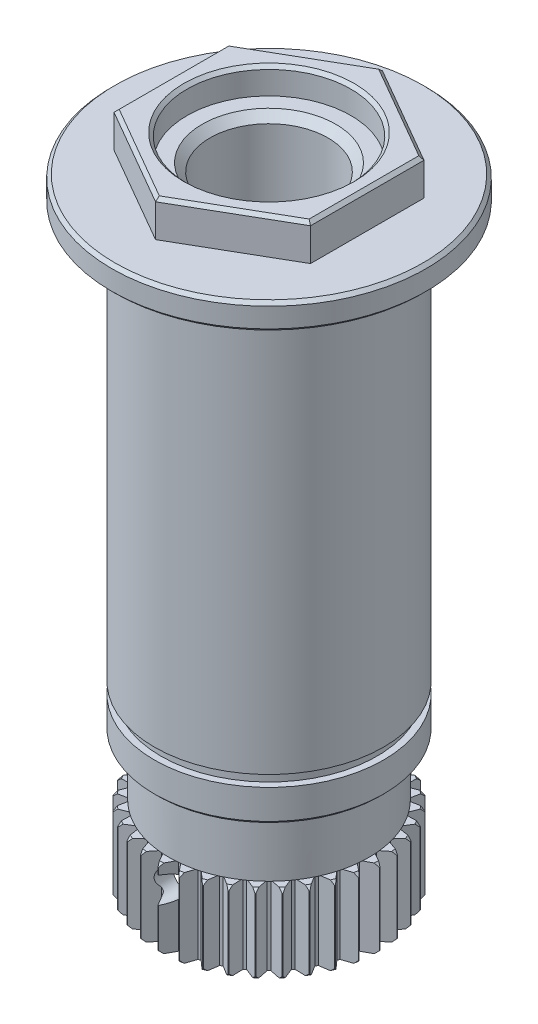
SolidWorks part; units mm, degrees
ref_plane "Plan de face" through (0, 0, 0) normal (0, 0, 1) x (1, 0, 0)
ref_plane "Plan de dessus" through (0, 0, 0) normal (0, 1, 0) x (1, 0, 0)
ref_plane "Plan de droite" through (0, 0, 0) normal (1, 0, 0) x (0, 0, -1)
sketch "Esquisse1" plane through (0, 0, 0) normal (0, 0, 1) x (1, 0, 0)
  line L0 (0, 102.8382) -> (0, -101.254) construction
  line L1 (-12.5, 9.5) -> (-12.5, 5.5)
  line L2 (-12.5, 5.5) -> (-9, 5.5)
  line L3 (-9, 5.5) -> (-9, -6.5)
  line L4 (-12.5, 9.5) -> (-15, 9.5)
  line L5 (-15, 9.5) -> (-15, 4)
  line L6 (-15, 4) -> (-24, 4)
  line L7 (-24, 4) -> (-24, 0)
  line L8 (-24, 0) -> (-17.5, 0)
  line L9 (-17.5, 0) -> (-17.5, -63)
  line L10 (-9, -6.5) -> (-8.1, -6.5)
  line L11 (-8.1, -6.5) -> (-8.1, -60)
  line L20 (-8.1, -60) -> (-9, -60)
  line L21 (-9, -60) -> (-9, -74.7)
  line L23 (-12.85, -74.7) -> (-9, -74.7)
  line L24 (-12.85, -74.7) -> (-12.85, -90.7)
  line L25 (-17.5, -63) -> (-16.5, -63)
  line L26 (-16.5, -63) -> (-16.5, -64.7)
  line L27 (-16.5, -64.7) -> (-17.5, -64.7)
  line L28 (-17.5, -64.7) -> (-17.5, -69.7)
  line L29 (-17.5, -69.7) -> (-15.25, -69.7)
  line L30 (-15.25, -69.7) -> (-15.25, -78.7)
  line L31 (-15.25, -78.7) -> (-16.9, -78.7)
  line L33 (-16.9, -90.7) -> (-12.85, -90.7)
  line L38 (-16.9, -78.7) -> (-16.9, -90.7)
  dimension "D1" = 9
  dimension "D2" = 12.5
  dimension "D3" = 15
  dimension "D4" = 4
  dimension "D5" = 5.5
  dimension "D6" = 24
  dimension "D7" = 17.5
  dimension "D8" = 12
  dimension "D9" = 8.1
  dimension "D10" = 64.7
  dimension "D11" = 16.9
  dimension "D12" = 4
  dimension "D13" = 30.7
  dimension "D19" = 9
  dimension "D20" = 16
  dimension "D22" = 12.85
  dimension "D24" = 100.2
  dimension "D26" = 1.7
  dimension "D27" = 16.5
  dimension "D28" = 17.5
  dimension "D30" = 15.25
  dimension "D31" = 9
  dimension "D33" = 12
revolve "Révolution1" add sketch "Esquisse1" angle 360 about L0
sketch "Esquisse7" plane through (0, 9.5, 0) normal (0, 1, 0) x (-1, 0, 0)
  line L0 (28.486, 0) -> (-27.1796, 0) construction
  line L1 (0, 0) -> (0, -29.2118) construction
  line L2 (0, 0) -> (0, 28.7037) construction
  line L3 (15, -8.6603) -> (15, 8.6603)
  line L4 (-15, -8.6603) -> (-15, 8.6603)
  line L5 (15, 8.6603) -> (0, 17.3205)
  line L6 (0, 17.3205) -> (-15, 8.6603)
  line L7 (15, -8.6603) -> (0, -17.3205)
  line L8 (0, -17.3205) -> (-15, -8.6603)
  circle A1 centre (0, 0) radius 12.5 construction
  circle A2 centre (0, 0) radius 12.5
  dimension "D1" = 30
  dimension "D2" = 30
  dimension "D3" = 30
  dimension "D4" = 120
extrude "Extrusion2" add sketch "Esquisse7" against normal up to surface (5.5 mm away)
sketch "Esquisse10" plane through (0, 0, 0) normal (0, 0, 1) x (1, 0, 0)
  line L0 (-26.0151, -82.2) -> (5.561, -82.2) construction
  line L1 (-16.9, -90.7) -> (16.9, -90.7) construction
  line L2 (0, -115.1209) -> (0, -49.2791) construction
  line L3 (0, 102.8382) -> (0, -101.254) construction
  circle A0 centre (0, -82.2) radius 2
  dimension "D3" = 4
  dimension "D1" = 8.5
extrude "Enlèv. mat.-Extru.12" cut sketch "Esquisse10" against normal mid plane 43
chamfer "Chanfrein1" distance 0.5 angle 45 8 edges at (0, -69.7, 17.5) (0, -6.5, 8.1) (0, -60, 8.1) (0, -78.7, 16.9) (0, -90.7, 16.9) (0, 0, 24) (0, 4, 24) (0, 9.5, 12.5)
sketch "Esquisse12" plane through (0, -90.7, 0) normal (0, -1, 0) x (1, 0, 0)
  line L0 (0, 0) -> (0, 24) construction
  line L1 (-1.3073, 14.9429) -> (-1.5311, 17.5)
  line L2 (0, 17) -> (1.1077, 14.959)
  line L3 (0, 17) -> (-1.1077, 14.959)
  line L4 (1.3073, 14.9429) -> (1.5311, 17.5)
  line L5 (-1.5311, 17.5) -> (1.5311, 17.5)
  circle A0 centre (0, 0) radius 17 construction
  circle A1 centre (0, 0) radius 17.5 construction
  circle A2 centre (0, 0) radius 24 construction
  arc A3 (-1.1077, 14.959) -> (-1.3073, 14.9429) centre (0, 0) ccw
  arc A4 (1.1077, 14.959) -> (1.3073, 14.9429) centre (0, 0) cw
  point P19 (0, 17.5)
  dimension "D1" = 15
  dimension "D2" = 5
  dimension "D5" = 28.49
extrude "Enlèv. mat.-Extru.13" cut sketch "Esquisse12" against normal blind 12
pattern_circular "Répétition circulaire2" count 36 every 10 about axis through (0, 0, 0) along (0, 1, 0) of "Enlèv. mat.-Extru.13"
chamfer "Chanfrein2" distance 1.2 angle 45 2 edges at (0, 5.5, 9) (0, -74.7, 9)
chamfer "Chanfrein3" distance 0.5 angle 45 6 edges at (-15, 9.5, 0) (-7.5, 9.5, -12.9904) (7.5, 9.5, -12.9904) (15, 9.5, 0) (7.5, 9.5, 12.9904) (-7.5, 9.5, 12.9904)
sketch "Esquisse11" plane through (0, 0, 0) normal (0, 0, 1) x (1, 0, 0)
  line L0 (-15, 9.5) -> (0, 9.5) construction
  line L1 (-10.4, -9.5) -> (0, -9.5)
  line L2 (-10.4, -9.5) -> (-10.4, -12.4)
  line L3 (-10.4, -12.4) -> (0, -12.4)
  line L4 (0, -9.5) -> (0, -12.4)
  line L5 (0, 102.8382) -> (0, -101.254) construction
  point P8 (-10.4, -10.95)
  dimension "D1" = 19
  dimension "D2" = 2.9
  dimension "D3" = 10.4
revolve "Enlèvement de matière-Révolution1" cut sketch "Esquisse11" angle 360 about axis through (0, 102.8382, 0) along (0, -1, 0)
ref_plane "Plan1" through (0, -10.95, 0) normal (0, 1, 0) x (-1, 0, 0)
fillet "Congé1" radius 0.1 2 edges at (0, -12.4, -8.1) (0, -9.5, 8.1)
fillet "Congé2" radius 0.13 2 edges at (0, -12.4, 10.4) (0, -9.5, 10.4)
pattern_linear "Répétition linéaire1" count 2 spacing 44.3 along (0, -1, 0) of "Enlèvement de matière-Révolution1"
sketch "Esquisse13" plane through (0, 0, 0) normal (0, 0, 1) x (1, 0, 0)
  line L1 (-26.6054, 52.4813) -> (25.0123, 52.4813)
  line L2 (-26.6054, 52.4813) -> (-26.6054, -53.9402)
  line L3 (-26.6054, -53.9402) -> (25.0123, -53.9402)
  line L4 (25.0123, 52.4813) -> (25.0123, -53.9402)
extrude "COUPE" [suppressed] cut sketch "Esquisse13" along normal blind 28
